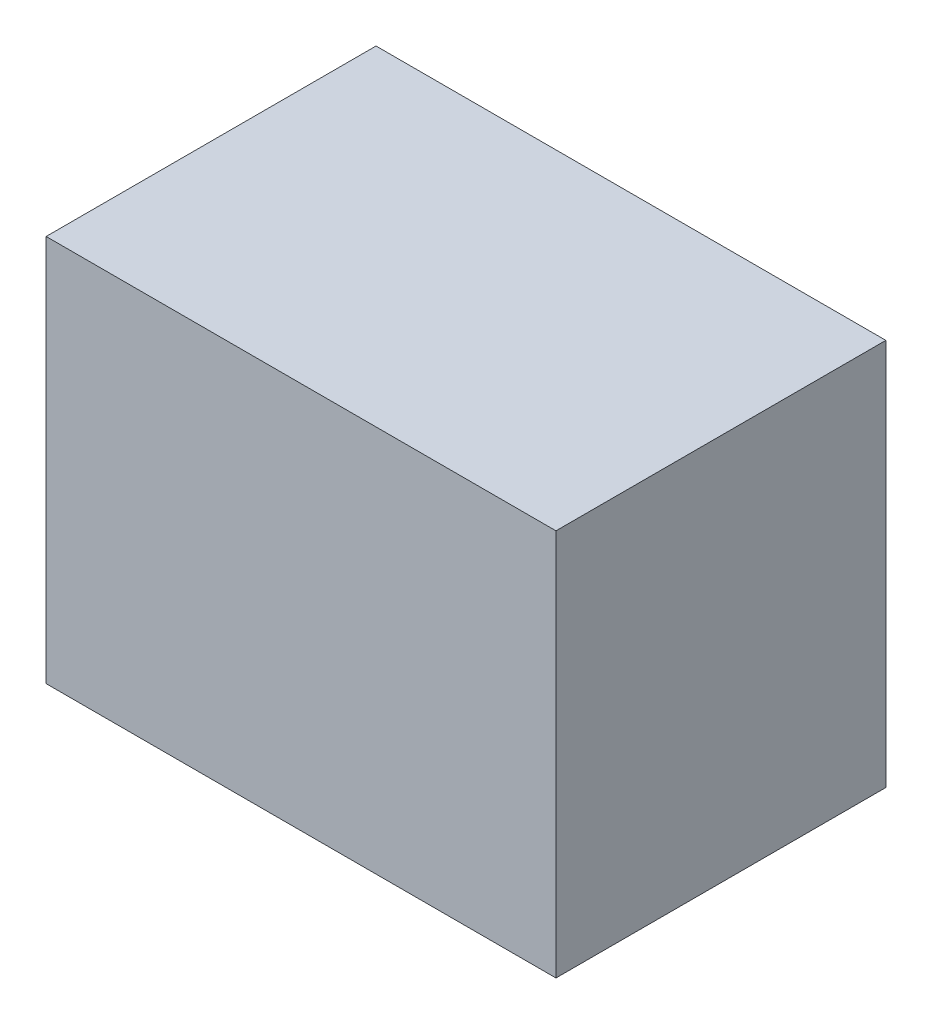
SolidWorks part; units mm, degrees
ref_plane "Front Plane" through (0, 0, 0) normal (0, 0, 1) x (1, 0, 0)
ref_plane "Top Plane" through (0, 0, 0) normal (0, 1, 0) x (1, 0, 0)
ref_plane "Right Plane" through (0, 0, 0) normal (1, 0, 0) x (0, 0, -1)
sketch "Sketch1" plane through (0, 0, 0) normal (0, 1, 0) x (1, 0, 0)
  line L1 (-107.95, 69.85) -> (107.95, 69.85)
  line L2 (-107.95, 69.85) -> (-107.95, -69.85)
  line L3 (-107.95, -69.85) -> (107.95, -69.85)
  line L4 (107.95, 69.85) -> (107.95, -69.85)
  line L5 (-107.95, 69.85) -> (107.95, -69.85) construction
  line L6 (-107.95, -69.85) -> (107.95, 69.85) construction
  point P0 (0, 0)
  dimension "D1" = 215.9
  dimension "D2" = 139.7
extrude "Boss-Extrude1" add sketch "Sketch1" along normal blind 164
